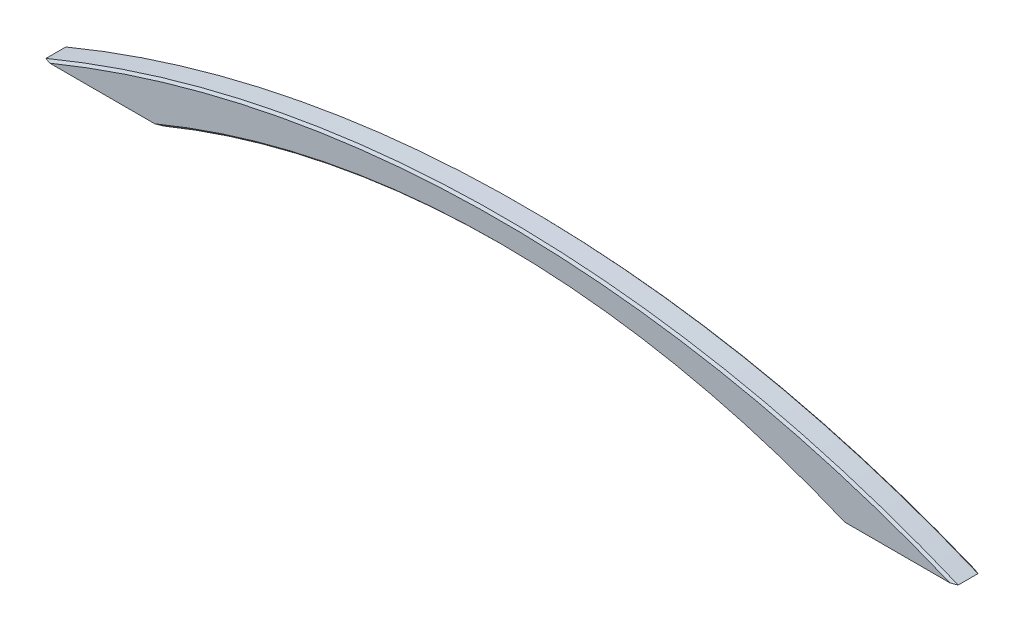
SolidWorks part; units mm, degrees
ref_plane "正面" through (0, 0, 0) normal (0, 0, 1) x (1, 0, 0)
ref_plane "平面" through (0, 0, 0) normal (0, 1, 0) x (1, 0, 0)
ref_plane "右側面" through (0, 0, 0) normal (1, 0, 0) x (0, 0, -1)
sketch "ｽｹｯﾁ1" plane through (0, 0, 0) normal (0, 0, 1) x (1, 0, 0)
  line L0 (-111.5, 0) -> (-150, 0)
  line L1 (150, 0) -> (111.5, 0)
  line L2 (0, 0) -> (0, 70.3267) construction
  arc A0 (-150, 0) -> (150, 0) centre (0, -360) cw
  arc A1 (-111.5, 0) -> (111.5, 0) centre (0, -271.5511) cw
  dimension "D3" = 8
  dimension "D4" = 30
  dimension "D1" = 300
  dimension "D2" = 223
extrude "ﾎﾞｽ - 押し出し1" add sketch "ｽｹｯﾁ1" along normal mid plane 8
hole_wizard "M4x0.7 ねじ穴1" positions "ｽｹｯﾁ2" profile "ｽｹｯﾁ3" tap size "M4x0.7" standard "Ansi Metric"
sketch "ｽｹｯﾁ2" plane through (0, 0, 0) normal (0, -1, 0) x (-1, 0, 0)
  line L0 (125, 0) -> (-125, 0) construction
  point P0 (125, 0)
  point P2 (-125, 0)
  dimension "D1" = 250
sketch "ｽｹｯﾁ3" plane through (-125, 0, 0) normal (1, 0, 0) x (0, 0, -1)
  line L0 (0, 0) -> (0, 6.9914)
  line L1 (0, 6.9914) -> (1.65, 6)
  line L2 (1.65, 6) -> (1.65, 0)
  line L5 (1.65, 0) -> (0, 0)
  line L10 (0, 6.9914) -> (-1.65, 6) construction
  line L11 (0, -6.35) -> (0, 107.95) construction
  dimension "ねじ下穴ﾄﾞﾘﾙ直径" = 3.3
  dimension "ねじ下穴ﾄﾞﾘﾙの深さ" = 6
  dimension "ﾄﾞﾘﾙ角度" = 118
chamfer "面取り1" distance 0.75 angle 45 4 edges at (0, 22, -4) (0, 22, 4) (0, 30, -4) (0, 30, 4)
